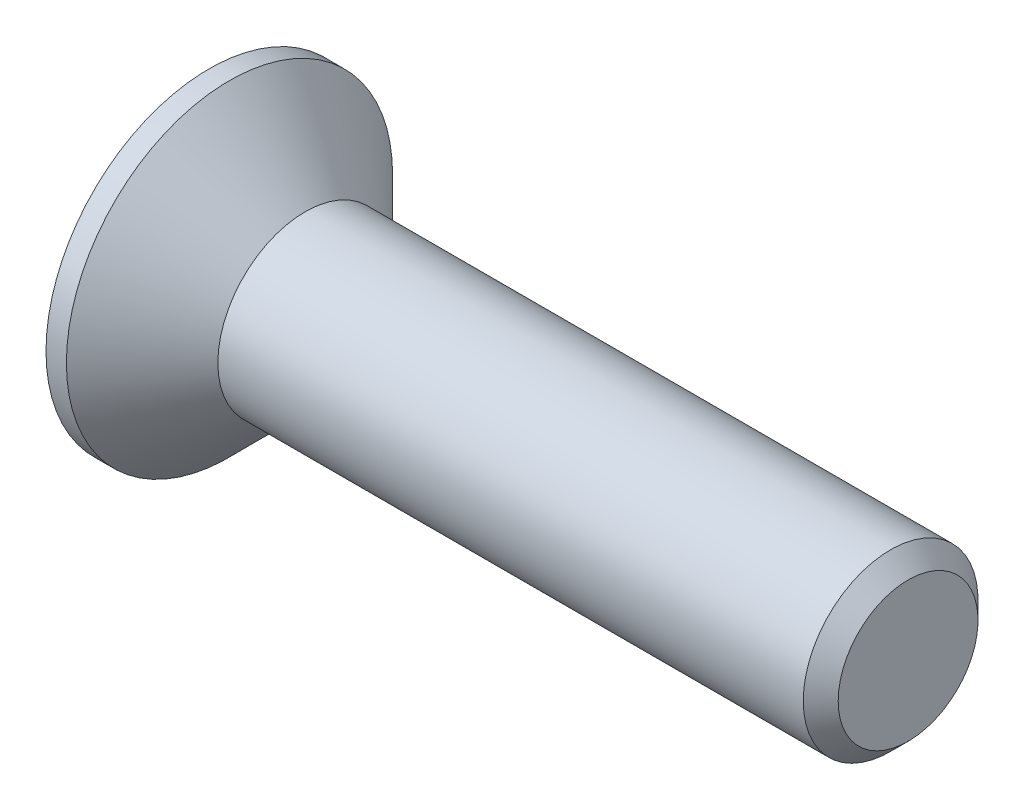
SolidWorks part; units mm, degrees
ref_plane "Front Plane" through (0, 0, 0) normal (0, 0, 1) x (1, 0, 0)
ref_plane "Top Plane" through (0, 0, 0) normal (0, 1, 0) x (1, 0, 0)
ref_plane "Right Plane" through (0, 0, 0) normal (1, 0, 0) x (0, 0, -1)
sketch "Sketch1" plane through (0, 0, 0) normal (0, 0, 1) x (1, 0, 0)
  line L1 (-1.65, 2.8) -> (-1.65, 0)
  line L2 (-1.65, 0) -> (10.35, 0)
  line L3 (10.35, 0) -> (10.35, 1.5)
  line L4 (10.35, 1.5) -> (0, 1.5)
  line L5 (-1.65, 2.8) -> (-1.3, 2.8)
  line L6 (-1.3, 2.8) -> (0, 1.5)
  dimension "D1" = 1.5
  dimension "D2" = 45
  dimension "D3" = 1.65
  dimension "D4" = 12
  dimension "D5" = 2.8
revolve "Revolve1" add sketch "Sketch1" angle 360 about L2
chamfer "Chamfer1" distance 0.3 angle 45 1 edges at (10.35, 0, 1.5)
sketch "Sketch2" plane through (-1.65, 0, 0) normal (-1, 0, 0) x (0, 0, 1)
  line L0 (-0.365, 1.45) -> (0.365, 1.45)
  line L1 (0.365, 1.45) -> (0.365, 0.365)
  line L2 (0.365, 0.365) -> (1.45, 0.365)
  line L3 (1.45, 0.365) -> (1.45, -0.365)
  line L4 (1.45, -0.365) -> (0.365, -0.365)
  line L5 (0.365, -0.365) -> (0.365, -1.45)
  line L6 (0.365, -1.45) -> (-0.365, -1.45)
  line L7 (-0.365, -1.45) -> (-0.365, -0.365)
  line L8 (-0.365, -0.365) -> (-1.45, -0.365)
  line L9 (-1.45, -0.365) -> (-1.45, 0.365)
  line L10 (-1.45, 0.365) -> (-0.365, 0.365)
  line L11 (-0.365, 0.365) -> (-0.365, 1.45)
  point P2 (0, 1.45)
  point P14 (0, -1.45)
  point P15 (1.45, 0)
  point P16 (-1.45, 0)
  dimension "D1" = 2.9
  dimension "D2" = 0.73
extrude "Cut-Extrude1" cut sketch "Sketch2" against normal blind 1.25
